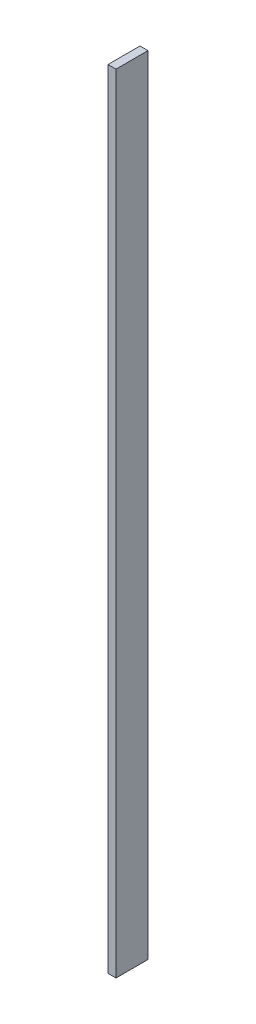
SolidWorks part; units mm, degrees
ref_plane "Front Plane" through (0, 0, 0) normal (0, 0, 1) x (1, 0, 0)
ref_plane "Top Plane" through (0, 0, 0) normal (0, 1, 0) x (1, 0, 0)
ref_plane "Right Plane" through (0, 0, 0) normal (1, 0, 0) x (0, 0, -1)
sketch "Sketch1" plane through (0, 0, 0) normal (0, 1, 0) x (1, 0, 0)
  line L1 (-3.175, 12.7) -> (3.175, 12.7)
  line L2 (-3.175, 12.7) -> (-3.175, -12.7)
  line L3 (-3.175, -12.7) -> (3.175, -12.7)
  line L4 (3.175, 12.7) -> (3.175, -12.7)
  line L5 (-3.175, 12.7) -> (3.175, -12.7) construction
  line L6 (-3.175, -12.7) -> (3.175, 12.7) construction
  point P0 (0, 0)
  dimension "D1" = 25.4
  dimension "D2" = 6.35
extrude "Boss-Extrude1" add sketch "Sketch1" along normal blind 624.84
